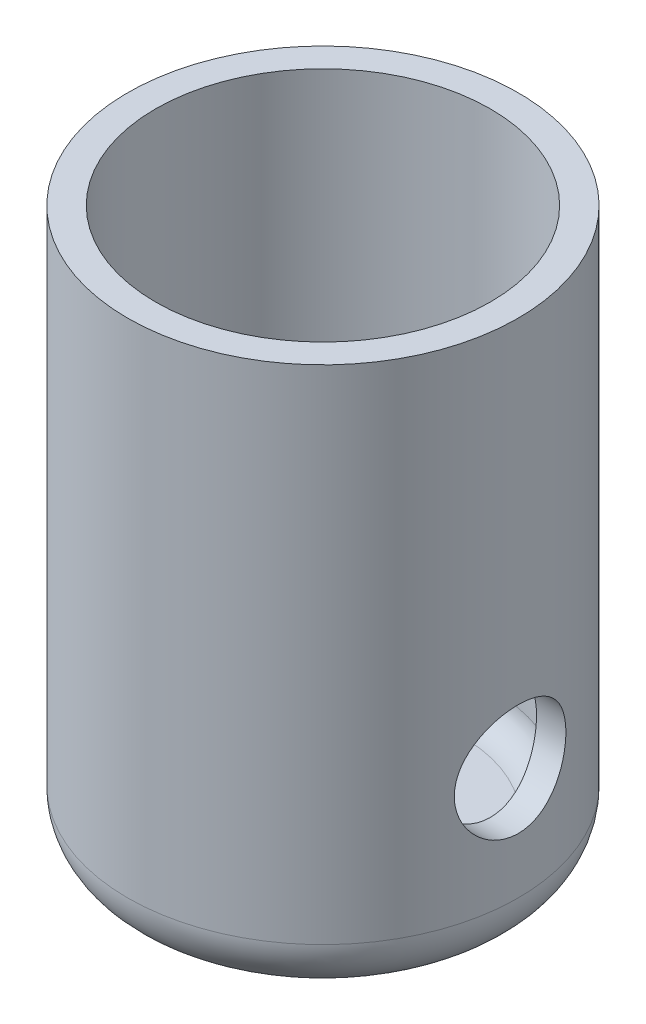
SolidWorks part; units mm, degrees
ref_plane "Plan de face" through (0, 0, 0) normal (0, 0, 1) x (1, 0, 0)
ref_plane "Plan de dessus" through (0, 0, 0) normal (0, 1, 0) x (1, 0, 0)
ref_plane "Plan de droite" through (0, 0, 0) normal (1, 0, 0) x (0, 0, -1)
sketch "Esquisse1" plane through (0, 0, 0) normal (0, 0, 1) x (1, 0, 0)
  line L0 (0.389, 23.2854) -> (0.389, 19.2854) construction
  line L1 (0.389, 23.2854) -> (0.389, 14.2854)
  line L3 (3.889, 30.795) -> (3.889, 12.3256) construction
  line L9 (1.389, 13.2854) -> (3.889, 13.2854)
  line L10 (0.389, 23.2854) -> (3.889, 23.2854)
  line L11 (0.389, 23.2854) -> (7.389, 23.2854) construction
  line L12 (3.889, 13.2854) -> (3.889, 23.2854)
  arc A0 (0.389, 14.2854) -> (1.389, 13.2854) centre (1.389, 14.2854) ccw
  point P8 (0.389, 13.2854)
  dimension "D2" = 1
  dimension "D1" = 10
revolve "Révolution1" add sketch "Esquisse1" angle 360 about L3
shell "Coque1" thickness 0.5
sketch "Esquisse2" plane through (0, 0, 0) normal (1, 0, 0) x (0, 0, -1)
  line L0 (0, 23.4577) -> (0, 13.0716) construction
  line L1 (-2.5, 13.2854) -> (2.5, 13.2854) construction
  circle A0 centre (0, 16.2854) radius 1
  dimension "D1" = 2
  dimension "D2" = 3
extrude "Enlèv. mat.-Extru.1" cut sketch "Esquisse2" against normal through all and the other way through all
